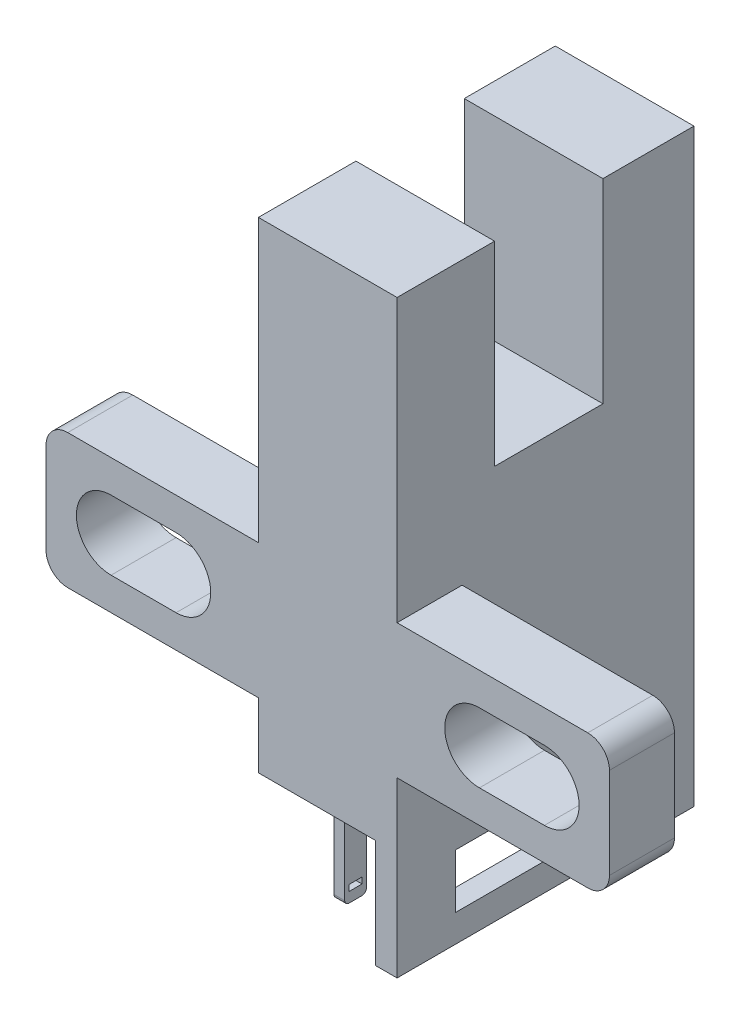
SolidWorks part; units mm, degrees
ref_plane "前视基准面" through (0, 0, 0) normal (0, 0, 1) x (1, 0, 0)
ref_plane "上视基准面" through (0, 0, 0) normal (0, 1, 0) x (1, 0, 0)
ref_plane "右视基准面" through (0, 0, 0) normal (1, 0, 0) x (0, 0, -1)
sketch "草图1" plane through (0, 0, 0) normal (0, 0, 1) x (1, 0, 0)
  line L1 (-13, 3.1) -> (13, 3.1)
  line L2 (-13, 3.1) -> (-13, -3.1)
  line L3 (-13, -3.1) -> (13, -3.1)
  line L4 (13, 3.1) -> (13, -3.1)
  line L5 (-13, 3.1) -> (13, -3.1) construction
  line L6 (-13, -3.1) -> (13, 3.1) construction
  point P0 (0, 0)
  dimension "D1" = 26
  dimension "D2" = 6.2
extrude "凸台-拉伸1" add sketch "草图1" along normal blind 3
fillet "圆角1" radius 1 4 edges at (-13, -3.1, 1.5) (13, -3.1, 1.5) (13, 3.1, 1.5) (-13, 3.1, 1.5)
sketch "草图2" plane through (0, 0, 3) normal (0, 0, 1) x (1, 0, 0)
  line L0 (-12, -3.1) -> (12, -3.1) construction
  line L1 (-3.2, 16.1) -> (3.2, 16.1)
  line L2 (-3.2, 16.1) -> (-3.2, -6.1)
  line L3 (-3.2, -6.1) -> (3.2, -6.1)
  line L4 (3.2, 16.1) -> (3.2, -6.1)
  line L5 (-3.2, 16.1) -> (3.2, -6.1) construction
  line L6 (-3.2, -6.1) -> (3.2, 16.1) construction
  point P0 (0, 5)
  dimension "D1" = 6.4
  dimension "D2" = 22.2
  dimension "D3" = 3
extrude "凸台-拉伸2" add sketch "草图2" against normal blind 13.7
sketch "草图3" plane through (0, -6.1, 0) normal (0, -1, 0) x (1, 0, 0)
  line L0 (-3.2, -10.7) -> (3.2, -10.7) construction
  line L1 (3.2, 3) -> (2.2, 3)
  line L2 (3.2, 3) -> (3.2, -10.7)
  line L3 (3.2, -10.7) -> (2.2, -10.7)
  line L4 (2.2, 3) -> (2.2, -10.7)
  dimension "D1" = 1
extrude "凸台-拉伸3" add sketch "草图3" along normal blind 5
sketch "草图4" plane through (2.2, 0, 0) normal (-1, 0, 0) x (0, 0, 1)
  line L1 (-7.7, -7.3298) -> (0.3, -7.3298)
  line L2 (-7.7, -7.3298) -> (-7.7, -9.8298)
  line L3 (-7.7, -9.8298) -> (0.3, -9.8298)
  line L4 (0.3, -7.3298) -> (0.3, -9.8298)
  line L5 (-7.7, -7.3298) -> (0.3, -9.8298) construction
  line L6 (-7.7, -9.8298) -> (0.3, -7.3298) construction
  point P0 (-3.7, -8.5798)
  dimension "D1" = 8
  dimension "D2" = 2.5
extrude "切除-拉伸1" cut sketch "草图4" against normal blind 5
ref_plane "基准面1" through (-1.2, 0, 0) normal (-1, 0, 0) x (0, 0, 1)
sketch "草图5" plane through (-1.2, 0, 0) normal (-1, 0, 0) x (0, 0, 1)
  line L0 (3, -6.1) -> (-10.7, -6.1) construction
  line L1 (-8.4835, -6.1) -> (-7.4835, -6.1)
  line L2 (-8.4835, -6.1) -> (-8.4835, -9.924)
  line L3 (-8.2835, -10.9338) -> (-7.6933, -10.9338)
  line L4 (-7.4835, -6.1) -> (-7.4835, -10.2121)
  line L5 (-7.4835, -10.2121) -> (-7.4835, -10.724)
  line L7 (-8.4835, -10.9338) -> (-8.2835, -10.9338)
  line L9 (-8.4835, -10.9338) -> (-9.0737, -10.9338)
  line L10 (-8.4835, -10.9338) -> (-8.4835, -10.1338)
  line L11 (-8.6933, -10.1338) -> (-9.0737, -10.1338)
  line L12 (-9.2835, -10.724) -> (-9.2835, -10.3437)
  arc A0 (-7.4835, -10.724) -> (-7.6933, -10.9338) centre (-7.6933, -10.724) cw
  arc A1 (-9.2835, -10.724) -> (-9.0737, -10.9338) centre (-9.0737, -10.724) ccw
  arc A2 (-8.4835, -9.924) -> (-8.6933, -10.1338) centre (-8.6933, -9.924) cw
  arc A3 (-9.2835, -10.3437) -> (-9.0737, -10.1338) centre (-9.0737, -10.3437) cw
  point P15 (-9.2835, -10.9338)
  point P21 (-9.2835, -10.1338)
  dimension "D2" = 0.8
  dimension "D4" = 0.2098
  dimension "D1" = 1
  dimension "D3" = 0.8
extrude "凸台-拉伸4" add sketch "草图5" against normal blind 0.5 contours L7 L3 A0 L5 L4 L1 L2 A2 L11 A3 L12 A1 L9
sketch "草图6" plane through (-1.2, 0, 0) normal (-1, 0, 0) x (0, 0, 1)
  line L0 (-9.0737, -10.9338) -> (-7.6933, -10.9338) construction
  line L1 (-8.7835, -10.3726) -> (-7.9835, -10.3726)
  line L2 (-8.7835, -10.3726) -> (-8.7835, -10.6726)
  line L3 (-8.7835, -10.6726) -> (-7.9835, -10.6726)
  line L4 (-7.9835, -10.3726) -> (-7.9835, -10.6726)
  line L5 (-8.7835, -10.3726) -> (-7.9835, -10.6726) construction
  line L6 (-8.7835, -10.6726) -> (-7.9835, -10.3726) construction
  point P0 (-8.3835, -10.5226)
  point P5 (-8.3835, -10.9338)
  dimension "D1" = 0.8
  dimension "D2" = 0.3
  dimension "D3" = 0
extrude "切除-拉伸2" cut sketch "草图6" against normal blind 0.5
sketch "草图7" plane through (-1.2, 0, 0) normal (-1, 0, 0) x (0, 0, 1)
  line L0 (3, -6.1) -> (-10.7, -6.1) construction
  line L1 (-4.4835, -6.1) -> (-5.4835, -6.1)
  line L2 (-4.4835, -6.1) -> (-4.4835, -10.6988)
  line L3 (-4.6835, -10.8988) -> (-5.2835, -10.8988)
  line L4 (-5.4835, -6.1) -> (-5.4835, -10.6988)
  line L5 (-10.7, -6.1) -> (3, -6.1) construction
  line L6 (-1.4835, -6.1) -> (-2.4835, -6.1)
  line L7 (-1.4835, -6.1) -> (-1.4835, -10.6988)
  line L8 (-1.6835, -10.8988) -> (-2.2835, -10.8988)
  line L9 (-2.4835, -6.1) -> (-2.4835, -10.6988)
  line L10 (-7.4835, -6.1) -> (-7.4835, -10.724) construction
  line L11 (1.5165, -6.1) -> (0.5165, -6.1)
  line L12 (1.5165, -6.1) -> (1.5165, -10.6988)
  line L13 (1.3165, -10.8988) -> (0.7165, -10.8988)
  line L14 (0.5165, -6.1) -> (0.5165, -10.6988)
  arc A0 (1.3165, -10.8988) -> (1.5165, -10.6988) centre (1.3165, -10.6988) ccw
  arc A1 (0.5165, -10.6988) -> (0.7165, -10.8988) centre (0.7165, -10.6988) ccw
  arc A2 (-1.6835, -10.8988) -> (-1.4835, -10.6988) centre (-1.6835, -10.6988) ccw
  arc A3 (-2.4835, -10.6988) -> (-2.2835, -10.8988) centre (-2.2835, -10.6988) ccw
  arc A4 (-4.6835, -10.8988) -> (-4.4835, -10.6988) centre (-4.6835, -10.6988) ccw
  arc A5 (-5.4835, -10.6988) -> (-5.2835, -10.8988) centre (-5.2835, -10.6988) ccw
  point P20 (1.5165, -10.8988)
  point P23 (0.5165, -10.8988)
  point P26 (-1.4835, -10.8988)
  point P29 (-2.4835, -10.8988)
  point P32 (-4.4835, -10.8988)
  point P35 (-5.4835, -10.8988)
  dimension "D7" = 0.2
  dimension "D1" = 1
  dimension "D2" = 1
  dimension "D3" = 1
  dimension "D4" = 2
  dimension "D5" = 2
  dimension "D6" = 2
extrude "凸台-拉伸5" add sketch "草图7" against normal blind 0.5
sketch "草图8" plane through (-1.2, 0, 0) normal (-1, 0, 0) x (0, 0, 1)
  line L1 (-5.2835, -10.1536) -> (-4.6835, -10.1536)
  line L2 (-5.2835, -10.1536) -> (-5.2835, -10.4335)
  line L3 (-5.2835, -10.4335) -> (-4.6835, -10.4335)
  line L4 (-4.6835, -10.1536) -> (-4.6835, -10.4335)
  line L5 (-5.2835, -10.1536) -> (-4.6835, -10.4335) construction
  line L6 (-5.2835, -10.4335) -> (-4.6835, -10.1536) construction
  point P0 (-4.9835, -10.2936)
extrude "切除-拉伸3" cut sketch "草图8" against normal blind 0.5
pattern_linear "阵列(线性)1" count 3 spacing 3 along (0, 0, 1) of "切除-拉伸3"
sketch "草图9" plane through (0, 0, 0) normal (0, 0, -1) x (-1, 0, 0)
  line L1 (-10, 1.6) -> (-7, 1.6)
  line L2 (-13, -2.1) -> (-13, 2.1) construction
  line L3 (-10, -1.6) -> (-7, -1.6)
  line L5 (-10, 1.6) -> (-7, -1.6) construction
  line L6 (-10, -1.6) -> (-7, 1.6) construction
  arc A0 (-10, 1.6) -> (-10, -1.6) centre (-10, 0) ccw
  arc A1 (-7, 1.6) -> (-7, -1.6) centre (-7, 0) cw
  point P0 (-8.5, 0)
  point P5 (-13, 0)
  dimension "D2" = 1.6
  dimension "D1" = 3
  dimension "D3" = 0
extrude "切除-拉伸4" cut sketch "草图9" against normal up to surface (3 mm away)
mirror "镜向1" about plane through (0, 0, 0) normal (1, 0, 0) of "切除-拉伸4"
sketch "草图10" plane through (-3.2, 0, 0) normal (-1, 0, 0) x (0, 0, 1)
  line L0 (-10.7, 16.1) -> (3, 16.1) construction
  line L1 (-6.5, 25.1) -> (-1.5, 25.1)
  line L2 (-6.5, 25.1) -> (-6.5, 7.1)
  line L3 (-6.5, 7.1) -> (-1.5, 7.1)
  line L4 (-1.5, 25.1) -> (-1.5, 7.1)
  line L5 (-6.5, 25.1) -> (-1.5, 7.1) construction
  line L6 (-6.5, 7.1) -> (-1.5, 25.1) construction
  line L7 (-10.7, 16.1) -> (-10.7, -6.1) construction
  point P0 (-4, 16.1)
  dimension "D1" = 5
  dimension "D2" = 4.2
  dimension "D3" = 9
extrude "切除-拉伸5" cut sketch "草图10" against normal up to surface (6.4 mm away)
other "冻结***"
